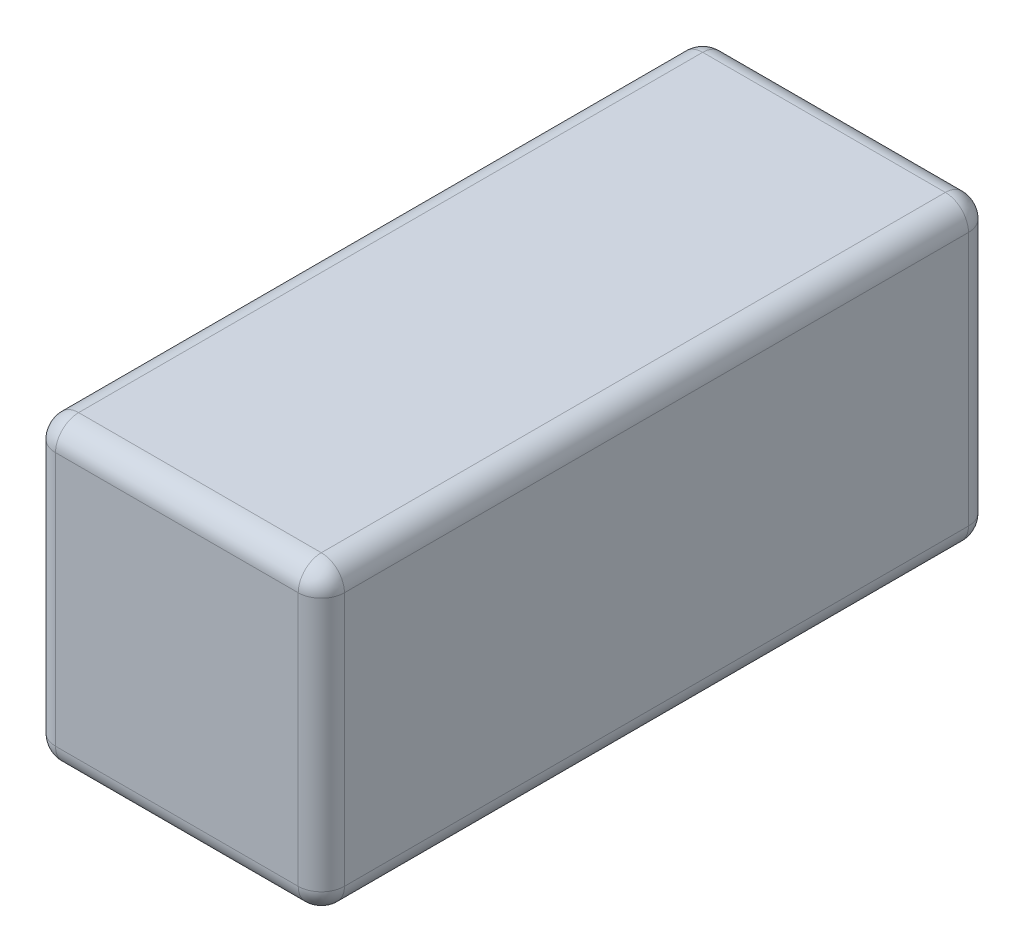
SolidWorks part; units mm, degrees
ref_plane "Front Plane" through (0, 0, 0) normal (0, 0, 1) x (1, 0, 0)
ref_plane "Top Plane" through (0, 0, 0) normal (0, 1, 0) x (1, 0, 0)
ref_plane "Right Plane" through (0, 0, 0) normal (1, 0, 0) x (0, 0, -1)
sketch "Sketch1" plane through (0, 0, 0) normal (0, 0, 1) x (1, 0, 0)
  line L1 (-12.5, 13) -> (12.5, 13)
  line L2 (-12.5, 13) -> (-12.5, -13)
  line L3 (-12.5, -13) -> (12.5, -13)
  line L4 (12.5, 13) -> (12.5, -13)
  line L5 (-12.5, 13) -> (12.5, -13) construction
  line L6 (12.5, 13) -> (-12.5, -13) construction
  point P4 (0, 0)
  dimension "D1" = 26
  dimension "D2" = 25
extrude "Boss-Extrude1" add sketch "Sketch1" along normal mid plane 58
fillet "Fillet1" radius 2 12 edges at (12.5, 13, 0) (12.5, -13, 0) (0, -13, 29) (0, 13, 29) (12.5, 0, 29) (-12.5, 0, 29) (-12.5, -13, 0) (12.5, 0, -29) (0, -13, -29) (-12.5, 0, -29) (0, 13, -29) (-12.5, 13, 0)
